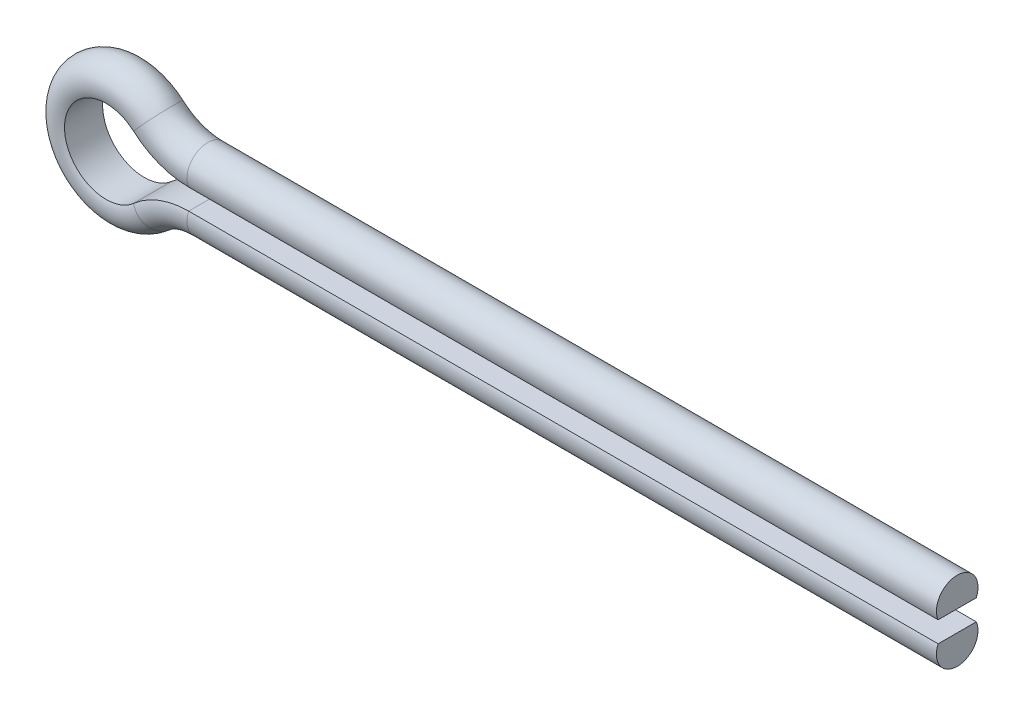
SolidWorks part; units mm, degrees
ref_plane "Front" through (0, 0, 0) normal (0, 0, 1) x (1, 0, 0)
ref_plane "Top" through (0, 0, 0) normal (0, 1, 0) x (1, 0, 0)
ref_plane "Right" through (0, 0, 0) normal (1, 0, 0) x (0, 0, -1)
sketch "Sketch1" plane through (0, 0, 0) normal (0, 0, 1) x (1, 0, 0)
  line L0 (0, 0) -> (-90.0784, 0)
  line L1 (-90.0784, 2.5) -> (0, 2.5)
  arc A0 (-90.0784, 0) -> (-96.6928, -2.5) centre (-90.0784, -10) ccw
  arc A1 (-96.6928, -2.5) -> (-96.6928, 5) centre (-100, 1.25) cw
  arc A2 (-96.6928, 5) -> (-90.0784, 2.5) centre (-90.0784, 12.5) ccw
  dimension "D1" = 10
  dimension "D3" = 5
  dimension "D2" = 100
  dimension "D4" = 2.5
  dimension "D5" = 1.25
sketch "Sketch2" plane through (0, 0, 0) normal (1, 0, 0) x (0, 0, -1)
  line L0 (2.2913, 0) -> (-2.2913, 0)
  arc A0 (-2.2913, 0) -> (2.2913, 0) centre (0, -1) ccw
  dimension "D1" = 3.5
  dimension "D2" = 5
sweep "Sweep1" add profiles "Sketch2" path "Sketch1"
